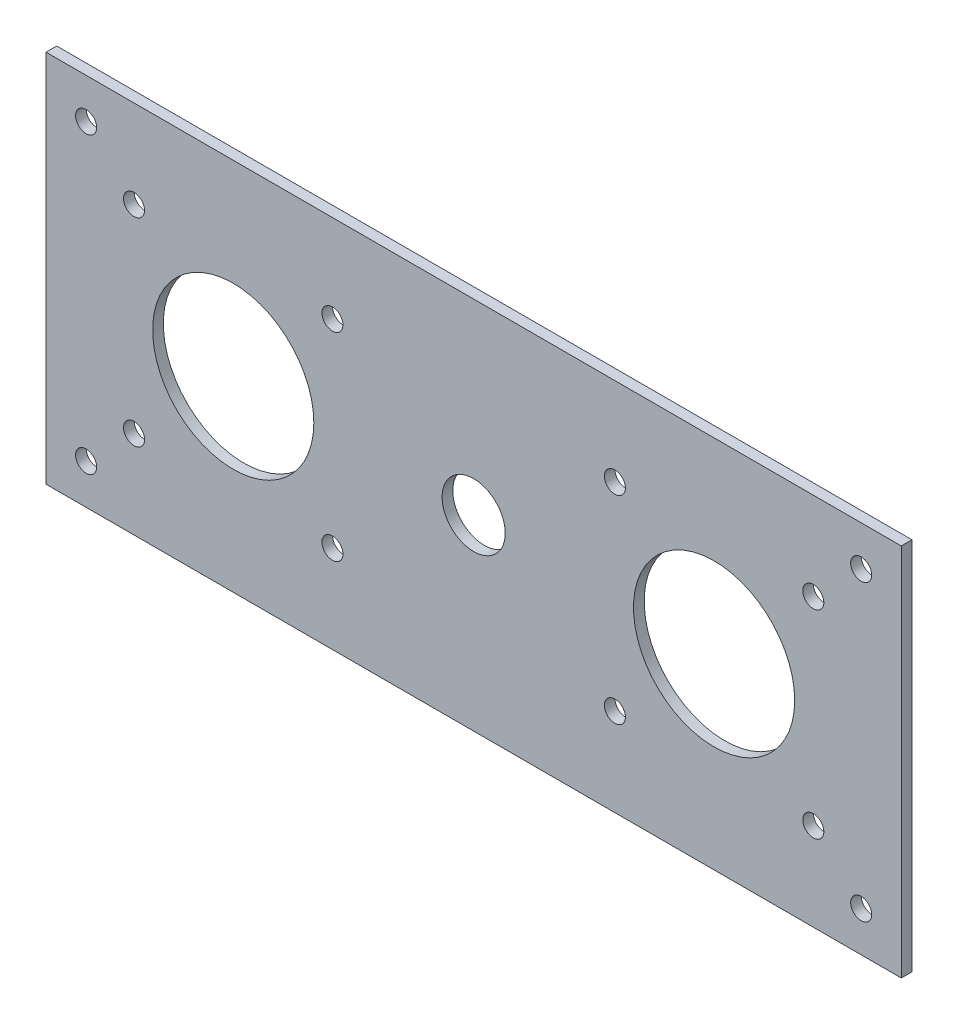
SolidWorks part; units mm, degrees
ref_plane "Front Plane" through (0, 0, 0) normal (0, 0, 1) x (1, 0, 0)
ref_plane "Top Plane" through (0, 0, 0) normal (0, 1, 0) x (1, 0, 0)
ref_plane "Right Plane" through (0, 0, 0) normal (1, 0, 0) x (0, 0, -1)
sketch "Sketch2" plane through (0, 0, 0) normal (0, 0, 1) x (1, 0, 0)
  line L0 (-33.555, 23.57) -> (-80.695, 23.57) construction
  line L1 (-101.6, -44.45) -> (101.6, -44.45)
  line L2 (-101.6, -44.45) -> (-101.6, 44.45)
  line L3 (-101.6, 44.45) -> (101.6, 44.45)
  line L4 (101.6, -44.45) -> (101.6, 44.45)
  line L5 (-101.6, -44.45) -> (101.6, 44.45) construction
  line L6 (-101.6, 44.45) -> (101.6, -44.45) construction
  line L7 (-80.695, 23.57) -> (-80.695, -23.57) construction
  line L8 (-80.695, -23.57) -> (-33.555, -23.57) construction
  line L9 (-33.555, -23.57) -> (-33.555, 23.57) construction
  line L10 (0, 0) -> (57.125, 0) construction
  line L11 (-57.125, 0) -> (-57.125, 23.57) construction
  line L12 (33.555, -23.57) -> (80.695, -23.57) construction
  line L13 (80.695, -23.57) -> (80.695, 23.57) construction
  line L14 (80.695, 23.57) -> (33.555, 23.57) construction
  line L15 (33.555, 23.57) -> (33.555, -23.57) construction
  line L16 (-57.125, 0) -> (-33.555, 0) construction
  line L17 (0, 0) -> (-57.125, 0) construction
  line L18 (57.125, 0) -> (33.555, 0) construction
  line L19 (57.125, 0) -> (57.125, 23.57) construction
  circle A0 centre (-80.695, -23.57) radius 2.5
  circle A1 centre (-33.555, -23.57) radius 2.5
  circle A2 centre (-33.555, 23.57) radius 2.5
  circle A3 centre (-80.695, 23.57) radius 2.5
  circle A4 centre (33.555, 23.57) radius 2.5
  circle A5 centre (80.695, 23.57) radius 2.5
  circle A7 centre (33.555, -23.57) radius 2.5
  circle A8 centre (80.695, -23.57) radius 2.5
  circle A9 centre (-57.125, 0) radius 19.15
  circle A10 centre (57.125, 0) radius 19.15
  point P0 (0, 0)
  dimension "D3" = 5
  dimension "D6" = 38.3
  dimension "D1" = 47.14
  dimension "D2" = 88.9
  dimension "D4" = 203.2
  dimension "D5" = 57.125
extrude "Boss-Extrude1" add sketch "Sketch2" along normal mid plane 2.54
sketch "Sketch3" plane through (0, 0, 1.27) normal (0, 0, 1) x (1, 0, 0)
  line L0 (-101.6, 34.925) -> (-92.075, 34.925) construction
  line L1 (-101.6, 44.45) -> (-101.6, -44.45) construction
  line L2 (-92.075, 34.925) -> (-92.075, 44.45) construction
  line L3 (101.6, 44.45) -> (-101.6, 44.45) construction
  line L4 (92.075, 44.45) -> (92.075, 34.925) construction
  line L5 (92.075, 34.925) -> (101.6, 34.925) construction
  line L6 (101.6, -44.45) -> (101.6, 44.45) construction
  line L7 (92.075, -44.45) -> (92.075, -34.925) construction
  line L8 (-101.6, -44.45) -> (101.6, -44.45) construction
  line L9 (92.075, -34.925) -> (101.6, -34.925) construction
  line L10 (-92.075, -44.45) -> (-92.075, -34.925) construction
  line L11 (-92.075, -34.925) -> (-101.6, -34.925) construction
  circle A0 centre (-92.075, 34.925) radius 2.5
  circle A1 centre (-92.075, -34.925) radius 2.5
  circle A2 centre (92.075, -34.925) radius 2.5
  circle A3 centre (92.075, 34.925) radius 2.5
  dimension "D2" = 5
  dimension "D1" = 9.525
extrude "Cut-Extrude1" cut sketch "Sketch3" against normal through all
sketch "Sketch4" plane through (0, 0, 1.27) normal (0, 0, 1) x (1, 0, 0)
  circle A0 centre (0, 0) radius 7.5
  dimension "D1" = 15
extrude "Cut-Extrude2" cut sketch "Sketch4" against normal through all both and the other way through all
sketch "Sketch5" plane through (0, 0, 1.27) normal (0, 0, 1) x (1, 0, 0)
  line L0 (80.695, 23.57) -> (85.695, 23.57) construction
  line L3 (80.695, 26.07) -> (85.695, 26.07)
  line L6 (80.695, 21.07) -> (85.695, 21.07)
  line L9 (80.695, -23.57) -> (85.695, -23.57) construction
  line L12 (80.695, -21.07) -> (85.695, -21.07)
  line L15 (80.695, -26.07) -> (85.695, -26.07)
  line L18 (33.555, -23.57) -> (38.555, -23.57) construction
  line L21 (33.555, 23.57) -> (38.555, 23.57) construction
  line L24 (57.125, 0) -> (62.125, 0) construction
  line L27 (57.125, 19.15) -> (62.125, 19.15)
  line L30 (57.125, -19.15) -> (62.125, -19.15)
  line L31 (-57.125, 0) -> (-62.125, 0) construction
  line L32 (33.555, 26.07) -> (38.555, 26.07)
  line L33 (33.555, 21.07) -> (38.555, 21.07)
  line L34 (33.555, -21.07) -> (38.555, -21.07)
  line L35 (33.555, -26.07) -> (38.555, -26.07)
  line L36 (-80.695, -23.57) -> (-85.695, -23.57) construction
  line L37 (-80.695, -26.07) -> (-85.695, -26.07)
  line L38 (-80.695, -21.07) -> (-85.695, -21.07)
  line L39 (-33.555, -23.57) -> (-38.555, -23.57) construction
  line L40 (-33.555, -26.07) -> (-38.555, -26.07)
  line L41 (-33.555, -21.07) -> (-38.555, -21.07)
  line L42 (-33.555, 23.57) -> (-38.555, 23.57) construction
  line L43 (-33.555, 21.07) -> (-38.555, 21.07)
  line L44 (-33.555, 26.07) -> (-38.555, 26.07)
  line L45 (-80.695, 23.57) -> (-85.695, 23.57) construction
  line L46 (-80.695, 21.07) -> (-85.695, 21.07)
  line L47 (-80.695, 26.07) -> (-85.695, 26.07)
  line L48 (-57.125, -19.15) -> (-62.125, -19.15)
  line L49 (-57.125, 19.15) -> (-62.125, 19.15)
  line L50 (62.125, -19.15) -> (62.125, 19.15) construction
  line L51 (-62.125, -19.15) -> (-62.125, 19.15) construction
  arc A22 (33.555, 26.07) -> (33.555, 21.07) centre (33.555, 23.57) ccw
  arc A23 (38.555, 21.07) -> (38.555, 26.07) centre (38.555, 23.57) ccw
  arc A25 (80.695, 26.07) -> (80.695, 21.07) centre (80.695, 23.57) ccw
  arc A26 (85.695, 21.07) -> (85.695, 26.07) centre (85.695, 23.57) ccw
  arc A27 (80.695, -21.07) -> (80.695, -26.07) centre (80.695, -23.57) ccw
  arc A28 (85.695, -26.07) -> (85.695, -21.07) centre (85.695, -23.57) ccw
  arc A29 (33.555, -21.07) -> (33.555, -26.07) centre (33.555, -23.57) ccw
  arc A30 (38.555, -26.07) -> (38.555, -21.07) centre (38.555, -23.57) ccw
  arc A31 (-80.695, -26.07) -> (-80.695, -21.07) centre (-80.695, -23.57) ccw
  arc A32 (-85.695, -21.07) -> (-85.695, -26.07) centre (-85.695, -23.57) ccw
  arc A33 (-33.555, -26.07) -> (-33.555, -21.07) centre (-33.555, -23.57) ccw
  arc A34 (-38.555, -21.07) -> (-38.555, -26.07) centre (-38.555, -23.57) ccw
  arc A35 (-33.555, 21.07) -> (-33.555, 26.07) centre (-33.555, 23.57) ccw
  arc A36 (-38.555, 26.07) -> (-38.555, 21.07) centre (-38.555, 23.57) ccw
  arc A37 (-80.695, 21.07) -> (-80.695, 26.07) centre (-80.695, 23.57) ccw
  arc A38 (-85.695, 26.07) -> (-85.695, 21.07) centre (-85.695, 23.57) ccw
  arc A39 (57.125, 19.15) -> (57.125, -19.15) centre (57.125, 0) ccw
  arc A40 (62.125, -19.15) -> (62.125, 19.15) centre (62.125, 0) ccw
  arc A41 (-57.125, -19.15) -> (-57.125, 19.15) centre (-57.125, 0) ccw
  arc A42 (-62.125, 19.15) -> (-62.125, -19.15) centre (-62.125, 0) ccw
  point P2 (83.195, 23.57)
  point P8 (83.195, -23.57)
  point P16 (36.055, -23.57)
  point P26 (-83.195, -23.57)
  point P32 (-36.055, -23.57)
  point P40 (-36.055, 23.57)
  point P48 (-83.195, 23.57)
  point P58 (36.055, 23.57)
  point P66 (59.625, 0)
  point P72 (-59.625, 0)
  dimension "D6" = 5
  dimension "D1" = 5
  dimension "D2" = 5
  dimension "D3" = 5
  dimension "D4" = 5
  dimension "D5" = 5
  dimension "D7" = 5
  dimension "D8" = 5
  dimension "D9" = 5
  dimension "D10" = 5
  dimension "D11" = 38.3
extrude "Slots Cut-Extrude" [suppressed] cut sketch "Sketch5" against normal through all both and the other way through all
sketch "Sketch6" [suppressed] plane through (0, 0, -1.27) normal (0, 0, -1) x (-1, 0, 0)
  line L0 (62.125, 0) -> (62.125, 34.925) construction
  line L1 (-62.125, 0) -> (-62.125, 34.925) construction
  line L2 (-92.075, 34.925) -> (-80.0875, 34.925) construction
  line L3 (80.0875, 33.925) -> (44.1625, 33.925)
  line L4 (80.0875, 33.925) -> (80.0875, 35.925)
  line L5 (44.1625, 33.925) -> (44.1625, 35.925)
  line L6 (80.0875, 35.925) -> (44.1625, 35.925)
  line L7 (80.0875, 33.925) -> (44.1625, 35.925) construction
  line L8 (44.1625, 33.925) -> (80.0875, 35.925) construction
  line L9 (-80.0875, 33.925) -> (-44.1625, 33.925)
  line L10 (-80.0875, 33.925) -> (-80.0875, 35.925)
  line L11 (-44.1625, 33.925) -> (-44.1625, 35.925)
  line L12 (-80.0875, 35.925) -> (-44.1625, 35.925)
  line L13 (-80.0875, 33.925) -> (-44.1625, 35.925) construction
  line L14 (-44.1625, 33.925) -> (-80.0875, 35.925) construction
  point P6 (62.125, 34.925)
  point P7 (-62.125, 34.925)
  dimension "D1" = 2
  dimension "D2" = 35.925
extrude "Cut-Extrude3" [suppressed] cut sketch "Sketch6" against normal through all both and the other way through all
